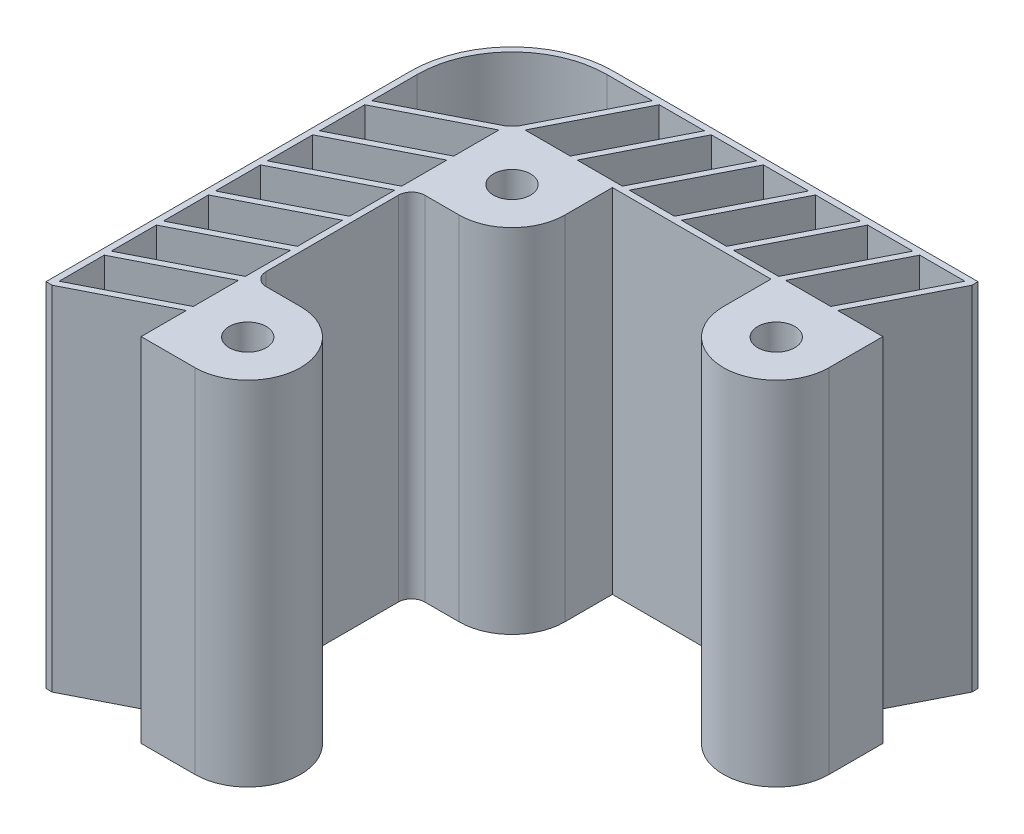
SolidWorks part; units mm, degrees
ref_plane "前视基准面" through (0, 0, 0) normal (0, 0, 1) x (1, 0, 0)
ref_plane "上视基准面" through (0, 0, 0) normal (0, 1, 0) x (1, 0, 0)
ref_plane "右视基准面" through (0, 0, 0) normal (1, 0, 0) x (0, 0, -1)
other "Configuration Table"
sketch "草图1" plane through (0, 0, 0) normal (0, 1, 0) x (1, 0, 0)
  line L8 (6, 0) -> (6, 5.4)
  line L9 (6, 5.4) -> (24, 5.4)
  line L10 (24, 5.4) -> (24, 0)
  line L16 (36, 0) -> (36, 16.9)
  line L18 (36, 16.9) -> (-16.9, 16.9)
  line L19 (-16.9, 16.9) -> (-16.9, -36)
  line L20 (-16.9, -36) -> (0, -36)
  line L21 (0, -24) -> (-5.4, -24)
  line L22 (-5.4, -24) -> (-5.4, -6)
  line L23 (-5.4, -6) -> (0, -6)
  circle A3 centre (0, -30) radius 2.1
  circle A5 centre (0, 0) radius 2.1
  arc A12 (0, -36) -> (0, -24) centre (0, -30) ccw
  arc A14 (0, -6) -> (6, 0) centre (0, 0) ccw
  arc A16 (24, 0) -> (36, 0) centre (30, 0) ccw
  circle A17 centre (30, 0) radius 2.1
  dimension "D13" = 4.2
  dimension "D25" = 6
  dimension "D3" = 18
  dimension "D6" = 6
  dimension "D4" = 5.4
  dimension "D5" = 16.9
  dimension "D14" = 30
extrude "凸台-拉伸1" add sketch "草图1" along normal blind 40
sketch "草图2" plane through (0, 40, 0) normal (0, 1, 0) x (1, 0, 0)
  line L3 (-16.2, 5.4) -> (-6.1, 10.5292) construction
  line L6 (0.0003, -0.0003) -> (30.4131, -30.4131) construction
  line L27 (-5.4, 6.1) -> (-0.2708, 16.2)
  line L92 (-6.1, 10.5292) -> (-6.1, 5.4) construction
  line L99 (-6.1, 5.4) -> (-16.2, 0.2708)
  line L110 (-16.2, 0.2708) -> (-16.2, 5.4)
  line L207 (-16.2, -0.5143) -> (-6.1, 4.6149)
  line L218 (-6.1, 4.6149) -> (-6.1, -0.5143)
  line L267 (-6.1, -0.5143) -> (-16.2, -5.6435)
  line L272 (-16.2, -5.6435) -> (-16.2, -0.5143)
  line L303 (-16.2, -6.4286) -> (-6.1, -1.2994)
  line L308 (-6.1, -1.2994) -> (-6.1, -6.4286)
  line L370 (-6.1, -6.4286) -> (-16.2, -11.5578)
  line L378 (-16.2, -11.5578) -> (-16.2, -6.4286)
  line L379 (-16.2, -12.3429) -> (-6.1, -7.2137)
  line L380 (-6.1, -7.2137) -> (-6.1, -12.3429)
  line L381 (-6.1, -12.3429) -> (-16.2, -17.472)
  line L382 (-16.2, -17.472) -> (-16.2, -12.3429)
  line L383 (-16.2, -18.2571) -> (-6.1, -13.128)
  line L385 (-6.1, -13.128) -> (-6.1, -18.2571)
  line L387 (-6.1, -18.2571) -> (-16.2, -23.3863)
  line L388 (-16.2, -23.3863) -> (-16.2, -18.2571)
  line L389 (-16.2, -24.1714) -> (-6.1, -19.0422)
  line L390 (-6.1, -19.0422) -> (-6.1, -24.1714)
  line L391 (-6.1, -24.1714) -> (-16.2, -29.3006)
  line L393 (-16.2, -29.3006) -> (-16.2, -24.1714)
  line L395 (-16.2, -30.0857) -> (-6.1, -24.9565)
  line L397 (-6.1, -24.9565) -> (-6.1, -30.0857)
  line L399 (-6.1, -30.0857) -> (-16.2, -35.2149)
  line L401 (-16.2, -35.2149) -> (-16.2, -30.0857)
  line L403 (-16.2, -36) -> (-6.1, -30.8708)
  line L405 (-6.1, -30.8708) -> (-6.1, -36)
  line L407 (-6.1, -36) -> (-16.2, -41.1292)
  line L409 (-16.2, -41.1292) -> (-16.2, -36)
  line L411 (-16.2, -41.9143) -> (-6.1, -36.7851)
  line L412 (-6.1, -36.7851) -> (-6.1, -41.9143)
  line L413 (-6.1, -41.9143) -> (-16.2, -47.0435)
  line L414 (-16.2, -47.0435) -> (-16.2, -41.9143)
  line L415 (-16.2, -47.8286) -> (-6.1, -42.6994)
  line L417 (-6.1, -42.6994) -> (-6.1, -47.8286)
  line L420 (-6.1, -47.8286) -> (-16.2, -52.9578)
  line L422 (-16.2, -52.9578) -> (-16.2, -47.8286)
  line L424 (-16.2, -53.7429) -> (-6.1, -48.6137)
  line L426 (-6.1, -48.6137) -> (-6.1, -53.7429)
  line L428 (-6.1, -53.7429) -> (-16.2, -58.872)
  line L430 (-16.2, -58.872) -> (-16.2, -53.7429)
  line L432 (-16.2, -59.6571) -> (-6.1, -54.528)
  line L434 (-6.1, -54.528) -> (-6.1, -59.6571)
  line L435 (-6.1, -59.6571) -> (-16.2, -64.7863)
  line L436 (-16.2, -64.7863) -> (-16.2, -59.6571)
  line L437 (-16.2, -65.5714) -> (-6.1, -60.4422)
  line L438 (-6.1, -60.4422) -> (-6.1, -65.5714)
  line L439 (-6.1, -65.5714) -> (-16.2, -70.7006)
  line L440 (-16.2, -70.7006) -> (-16.2, -65.5714)
  line L441 (-5.4, -24) -> (-5.4, -6) construction
  line L442 (-16.9, 16.9) -> (-16.9, -36) construction
  line L443 (-6.1, 5.4) -> (-5.4, 6.1)
  line L445 (-0.2708, 16.2) -> (-5.4, 16.2)
  line L446 (41.1292, 16.2) -> (36, 16.2)
  line L447 (-16.9, -36) -> (0, -36) construction
  line L448 (6, 5.4) -> (-35.1477, 5.4) construction
  line L449 (36, 6.1) -> (41.1292, 16.2)
  line L450 (30.8708, 6.1) -> (36, 6.1)
  line L451 (36, 16.2) -> (30.8708, 6.1)
  line L452 (35.2149, 16.2) -> (30.0857, 16.2)
  line L453 (30.0857, 6.1) -> (35.2149, 16.2)
  line L454 (24.9565, 6.1) -> (30.0857, 6.1)
  line L455 (30.0857, 16.2) -> (24.9565, 6.1)
  line L456 (29.3006, 16.2) -> (24.1714, 16.2)
  line L457 (24.1714, 6.1) -> (29.3006, 16.2)
  line L458 (19.0422, 6.1) -> (24.1714, 6.1)
  line L459 (24.1714, 16.2) -> (19.0422, 6.1)
  line L460 (23.3863, 16.2) -> (18.2571, 16.2)
  line L461 (18.2571, 6.1) -> (23.3863, 16.2)
  line L462 (13.128, 6.1) -> (18.2571, 6.1)
  line L463 (18.2571, 16.2) -> (13.128, 6.1)
  line L464 (17.472, 16.2) -> (12.3429, 16.2)
  line L465 (12.3429, 6.1) -> (17.472, 16.2)
  line L466 (7.2137, 6.1) -> (12.3429, 6.1)
  line L467 (12.3429, 16.2) -> (7.2137, 6.1)
  line L468 (11.5578, 16.2) -> (6.4286, 16.2)
  line L469 (6.4286, 6.1) -> (11.5578, 16.2)
  line L470 (1.2994, 6.1) -> (6.4286, 6.1)
  line L471 (6.4286, 16.2) -> (1.2994, 6.1)
  line L472 (5.6435, 16.2) -> (0.5143, 16.2)
  line L473 (0.5143, 6.1) -> (5.6435, 16.2)
  line L474 (-4.6149, 6.1) -> (0.5143, 6.1)
  line L475 (0.5143, 16.2) -> (-4.6149, 6.1)
  line L476 (-16.9, 5.4) -> (-16.9, 16.9)
  line L477 (-16.9, 16.9) -> (-5.4, 16.9)
  arc A0 (-5.1371, 4.9497) -> (-5.1492, 5.1492) centre (-4.9516, 5.061) cw
  arc A2 (-16.2, 5.4) -> (-5.4, 16.2) centre (-5.4, 5.4) cw
  arc A3 (-16.9, 5.4) -> (-5.4, 16.9) centre (-5.4, 5.4) cw
  point P5 (-250.7, -262)
  point P9 (-250.7, -255)
  point P10 (-250.7, -248)
  point P11 (-250.7, -241)
  point P15 (-250.7, -234)
  point P17 (-250.7, -227)
  point P18 (-250.7, -220)
  point P19 (-250.7, -213)
  point P20 (-250.7, -206)
  point P21 (-250.7, -199)
  point P22 (-247.2, -174.5)
  point P23 (-250.7, -192)
  point P24 (-250.7, -185)
  point P25 (-250.7, -178)
  point P26 (-247.2, -265.5)
  point P27 (-247.2, -258.5)
  point P28 (-247.2, -251.5)
  point P29 (-247.2, -244.5)
  point P30 (-247.2, -237.5)
  point P31 (-247.2, -230.5)
  point P32 (-247.2, -181.5)
  point P33 (-247.2, -223.5)
  point P34 (-247.2, -216.5)
  point P35 (-247.2, -209.5)
  point P36 (-247.2, -202.5)
  point P37 (-247.2, -195.5)
  point P38 (-247.2, -188.5)
  dimension "D3" = 0.7
  dimension "D4" = 0.7
  dimension "D5" = 45
  dimension "D6" = 11.3278
  dimension "D2" = 0.7
  dimension "D1" = 13
fillet "圆角1" radius 1.5 2 edges at (-5.4, 20, 6) (-5.4, 20, 24)
extrude "切除-拉伸1" cut sketch "草图2" against normal through all contours A2 L110 L99 L443 L27 L445 | A3 M15 M13 | L272 L267 L218 L207 | L378 L370 L308 L303 | L382 L381 L380 L379 | L388 L387 L385 L383 | L393 L391 L390 L389 | L401 L399 L397 L395 | L405 L403 M17 | L472 L475 L474 L473 | L468 L471 L470 L469 | L464 L467 L466 L465 | L460 L463 L462 L461 | L456 L459 L458 L457 | L452 L455 L454 L453 | L451 L450 M639
